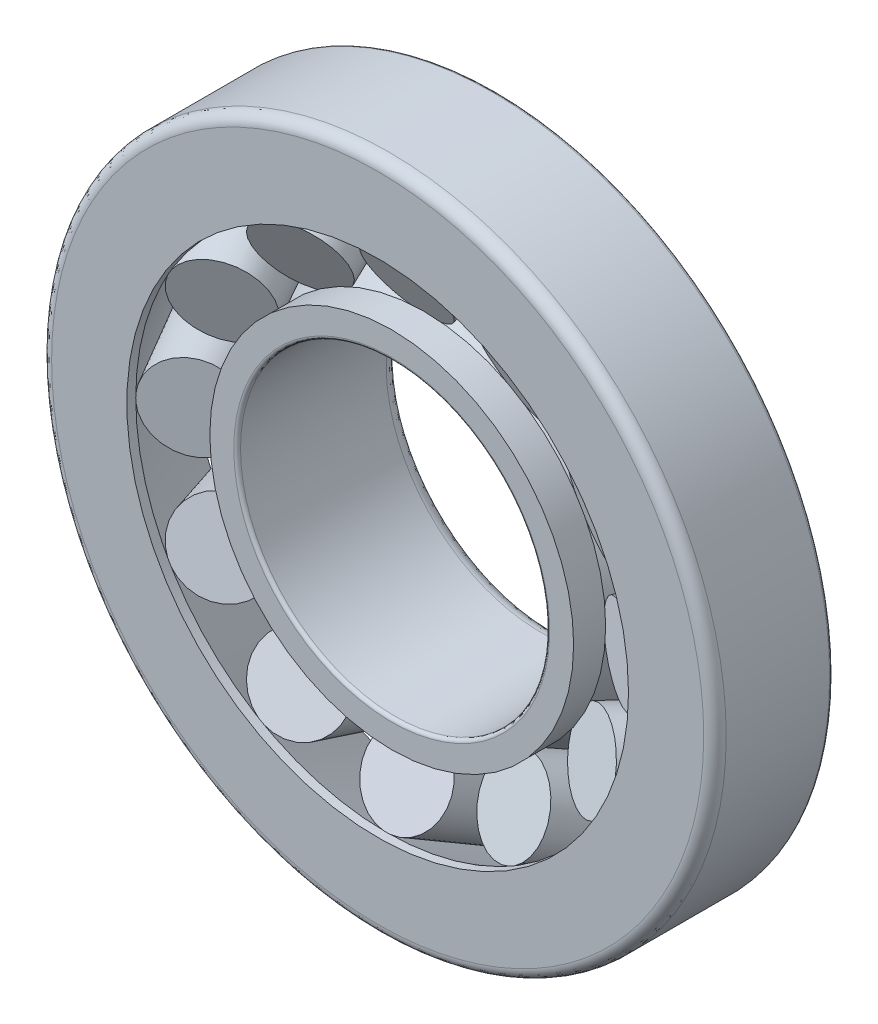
SolidWorks part; units mm, degrees
ref_plane "Front Plane" through (0, 0, 0) normal (0, 0, 1) x (1, 0, 0)
ref_plane "Top Plane" through (0, 0, 0) normal (0, 1, 0) x (1, 0, 0)
ref_plane "Right Plane" through (0, 0, 0) normal (1, 0, 0) x (0, 0, -1)
sketch "BaseSke" plane through (0, 0, 0) normal (1, 0, 0) x (0, 0, -1)
  line L0 (-47.2296, 0) -> (24.6132, 0) construction
  line L2 (0, 129.5214) -> (0, -86.3012) construction
  line L3 (2.5584, 53.7985) -> (-34.0584, 33.7015) construction
  line L4 (-31.5, 60) -> (-10.5, 60) construction
  line L5 (-29, 27.5) -> (0, 27.5) construction
  line L6 (-15.75, 43.75) -> (-28.7741, 67.48) construction
  line L7 (-29.925, 44.6425) -> (-12.075, 55.0565)
  line L8 (-12.075, 55.0565) -> (-8.1568, 47.9175)
  line L9 (-8.1568, 47.9175) -> (-26.2671, 37.9778)
  line L10 (-26.2671, 37.9778) -> (-29.925, 44.6425)
  line L11 (-31.5, 60) -> (-31.5, 44.625) construction
  line L12 (-29.9154, 44.625) -> (-10.5, 55.9523) construction
  line L13 (-10.5, 60) -> (-10.5, 55.9523) construction
  line L14 (-29.9154, 44.625) -> (-31.5, 44.625) construction
  line L15 (-22.6091, 31.313) -> (-4.2386, 40.7785) construction
  line L16 (-29, 27.5) -> (-29, 32.363) construction
  line L17 (-29, 32.363) -> (-23.2995, 32.363) construction
  line L18 (0, 41.8285) -> (0, 27.5) construction
  line L19 (-23.2995, 32.363) -> (-22.7221, 31.311) construction
  line L20 (-22.7221, 31.311) -> (-4.1737, 40.8682) construction
  line L21 (-4.1737, 40.8682) -> (-4.7008, 41.8285) construction
  line L22 (-4.7008, 41.8285) -> (0, 41.8285) construction
revolve "Roller" add sketch "BaseSke" angle 360 about L3
sketch "OuterRaceSke" plane through (0, 0, 0) normal (1, 0, 0) x (0, 0, -1)
  line L0 (-29.9154, 44.625) -> (-31.5, 44.625) construction
  line L1 (-29.9154, 44.625) -> (-10.5, 55.9523) construction
  line L2 (-10.5, 60) -> (-10.5, 55.9523) construction
  line L3 (-31.5, 60) -> (-10.5, 60) construction
  line L4 (-31.5, 60) -> (-31.5, 44.625) construction
  line L5 (-29.9154, 44.625) -> (-31.5, 44.625)
  line L6 (-29.9154, 44.625) -> (-10.5, 55.9523)
  line L7 (-10.5, 60) -> (-10.5, 55.9523)
  line L8 (-31.5, 60) -> (-10.5, 60)
  line L9 (-31.5, 60) -> (-31.5, 44.625)
  line L10 (-60.3939, 0) -> (35.9926, 0) construction
revolve "OuterRace" add sketch "OuterRaceSke" angle 360 about L10
sketch "InnerRaceSke" plane through (0, 0, 0) normal (1, 0, 0) x (0, 0, -1)
  line L0 (-29, 27.5) -> (0, 27.5) construction
  line L1 (-29, 27.5) -> (-29, 32.363) construction
  line L2 (-29, 32.363) -> (-23.2995, 32.363) construction
  line L3 (-23.2995, 32.363) -> (-22.7221, 31.311) construction
  line L4 (-22.7221, 31.311) -> (-4.1737, 40.8682) construction
  line L5 (-4.1737, 40.8682) -> (-4.7008, 41.8285) construction
  line L6 (-4.7008, 41.8285) -> (0, 41.8285) construction
  line L7 (0, 41.8285) -> (0, 27.5) construction
  line L8 (-29, 27.5) -> (0, 27.5)
  line L9 (-29, 27.5) -> (-29, 32.363)
  line L10 (-29, 32.363) -> (-23.2995, 32.363)
  line L11 (-23.2995, 32.363) -> (-22.7221, 31.311)
  line L12 (-22.7221, 31.311) -> (-4.1737, 40.8682)
  line L13 (-4.1737, 40.8682) -> (-4.7008, 41.8285)
  line L14 (-4.7008, 41.8285) -> (0, 41.8285)
  line L15 (0, 41.8285) -> (0, 27.5)
  line L16 (-58.1022, 0) -> (39.538, 0) construction
revolve "InnerRace" add sketch "InnerRaceSke" angle 360 about L16
fillet "Fillet1" radius 0.6 2 edges at (60, 0, 10.5) (27.5, 0, 29)
fillet "InnerFillet" radius 2.5 1 edges at (27.5, 0, 0)
fillet "OuterFillet" radius 2 1 edges at (60, 0, 31.5)
pattern_circular "CirPatternBall" count 12 over 360 about axis through (0, 0, 0) along (0, 0, 1) of "Roller"
sketch "Sketch4" plane through (0, 0, 0) normal (1, 0, 0) x (0, 0, -1)
  line L0 (-29.925, 44.6425) -> (-12.075, 55.0565)
  line L1 (-12.075, 55.0565) -> (-4.2386, 40.7785)
  line L2 (-4.2386, 40.7785) -> (-22.6091, 31.313)
  line L3 (-22.6091, 31.313) -> (-29.925, 44.6425)
  line L4 (-40.3293, 0) -> (19.5574, 0) construction
revolve "Simplified" [suppressed] add sketch "Sketch4" angle 360 about L4
equation "\"D2@BaseSke\" = \"Bearing_Thickness@BaseSke\"/2"
equation "\"D3@BaseSke\" =  ( \"Bearing_Outside_Diameter@BaseSke\" + \"Bearing_Inside_Diameter@BaseSke\" )  / 2"
equation "\"Roller_diameter@BaseSke\" = \"D3@BaseSke\"*1.02"
equation "\"D4@BaseSke\" = \"Bearing_Thickness@BaseSke\"/20"
equation "\"D5@BaseSke\" = \"Bearing_Thickness@BaseSke\" / 20"
equation "\"D8@BaseSke\" = \"Bearing_Thickness@BaseSke\"/30"
equation "\"D11@BaseSke\" = \"D8@BaseSke\""
equation "\"D1@CirPatternBall\" = int(  \"D3@BaseSke\" *  pi  /  ( \"Bearing_Outside_Diameter@BaseSke\" - \"Bearing_Inside_Diameter@BaseSke\" )  * 3) "
